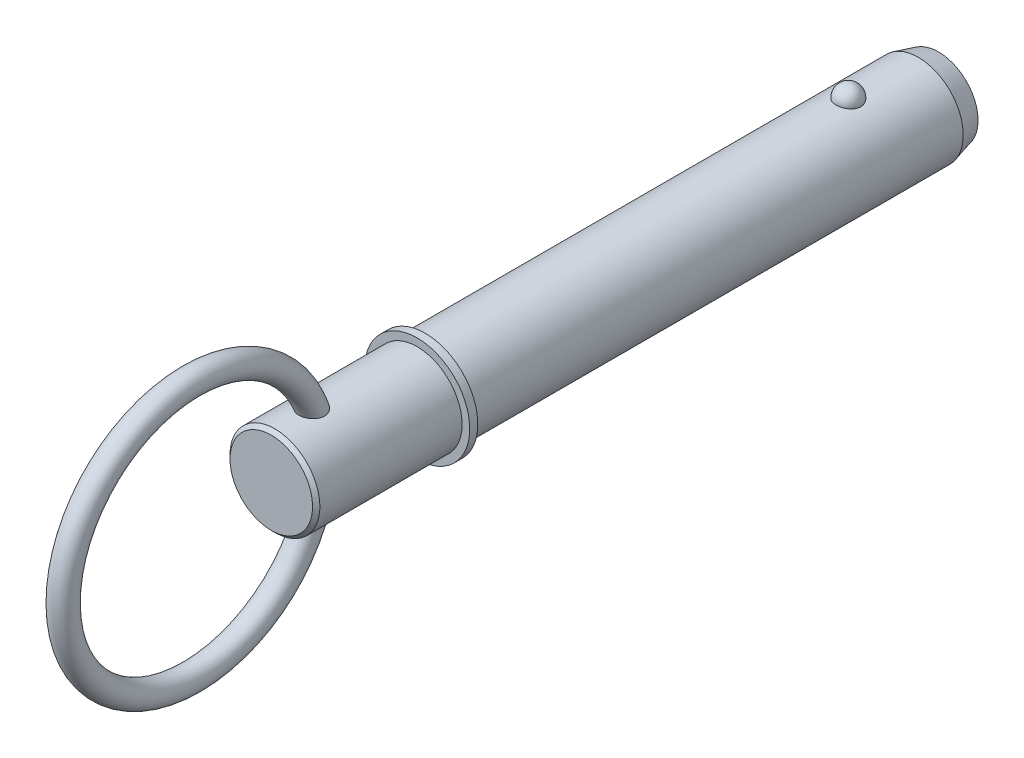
SolidWorks part; units mm, degrees
ref_plane "Front Plane" through (0, 0, 0) normal (0, 0, 1) x (1, 0, 0)
ref_plane "Top Plane" through (0, 0, 0) normal (0, 1, 0) x (1, 0, 0)
ref_plane "Right Plane" through (0, 0, 0) normal (1, 0, 0) x (0, 0, -1)
sketch "Sketch2" plane through (0, 0, 0) normal (0, 0, 1) x (1, 0, 0)
  circle A0 centre (0, 0) radius 11.115
  point P3 (0, 11.115)
  dimension "D1" = 22.23
extrude "Boss-Extrude1" add sketch "Sketch2" along normal blind 101.6
sketch "Sketch3" plane through (0, 0, 0) normal (0, 0, -1) x (-1, 0, 0)
  circle A0 centre (0, 0) radius 11.115
  dimension "D1" = 22.23
extrude "Boss-Extrude2" add sketch "Sketch3" along normal blind 25.4
chamfer "Chamfer1" distance 5 angle 15 1 edges at (-11.115, 0, -25.4)
sketch "Sketch18" plane through (0, 0, 0) normal (1, 0, 0) x (0, 0, -1)
  line L0 (20.4, 11.115) -> (-101.6, 11.115) construction
  line L1 (3.07, 14.185) -> (3.07, 8.045)
  line L2 (-101.6, -11.115) -> (20.4, -11.115) construction
  arc A0 (3.07, 14.185) -> (3.07, 8.045) centre (3.07, 11.115) ccw
  point P4 (0, 11.115)
  dimension "D1" = 25.3
revolve "Revolve1" add sketch "Sketch18" angle 360 about L1
sketch "Sketch19" plane through (0, 0, 0) normal (1, 0, 0) x (0, 0, -1)
  line L0 (-33.7288, 0) -> (-46.4542, 0) construction
sketch "Sketch20" plane through (0, 0, 0) normal (1, 0, 0) x (0, 0, -1)
  line L0 (-101.6, 0) -> (-101.6, 13)
  line L1 (-101.6, 11.115) -> (-101.6, -11.115) construction
  line L2 (-101.6, 13) -> (-103.6, 13)
  line L3 (-103.6, 13) -> (-103.6, 0)
  line L4 (-33.7288, 0) -> (-46.4542, 0) construction
  line L5 (-103.6, 0) -> (-101.6, 0)
  dimension "D1" = 13
  dimension "D2" = 2
revolve "Revolve2" add sketch "Sketch20" angle 360 about L0
sketch "Sketch21" plane through (0, 0, 101.6) normal (0, 0, -1) x (-1, 0, 0)
  circle A0 centre (0, 0) radius 11.115
  dimension "D1" = 22.23
extrude "Boss-Extrude3" add sketch "Sketch21" against normal blind 38.1
chamfer "Chamfer2" distance 0.9 angle 45 1 edges at (-11.115, 0, 139.7)
sketch "Sketch23" plane through (0, 0, 0) normal (1, 0, 0) x (0, 0, -1)
  line L0 (-139.7, 10.215) -> (-139.7, -10.215) construction
  circle A0 centre (-159.45, 0) radius 31.75
  point P2 (-127.7, 0)
  dimension "D1" = 63.5
  dimension "D2" = 12
sketch "Sketch24" plane through (0, 0, 0) normal (0, 1, 0) x (1, 0, 0)
  circle A0 centre (0, -127.7) radius 3
  dimension "D1" = 6
sweep "Sweep1" add profiles "Sketch24" path "Sketch23"
